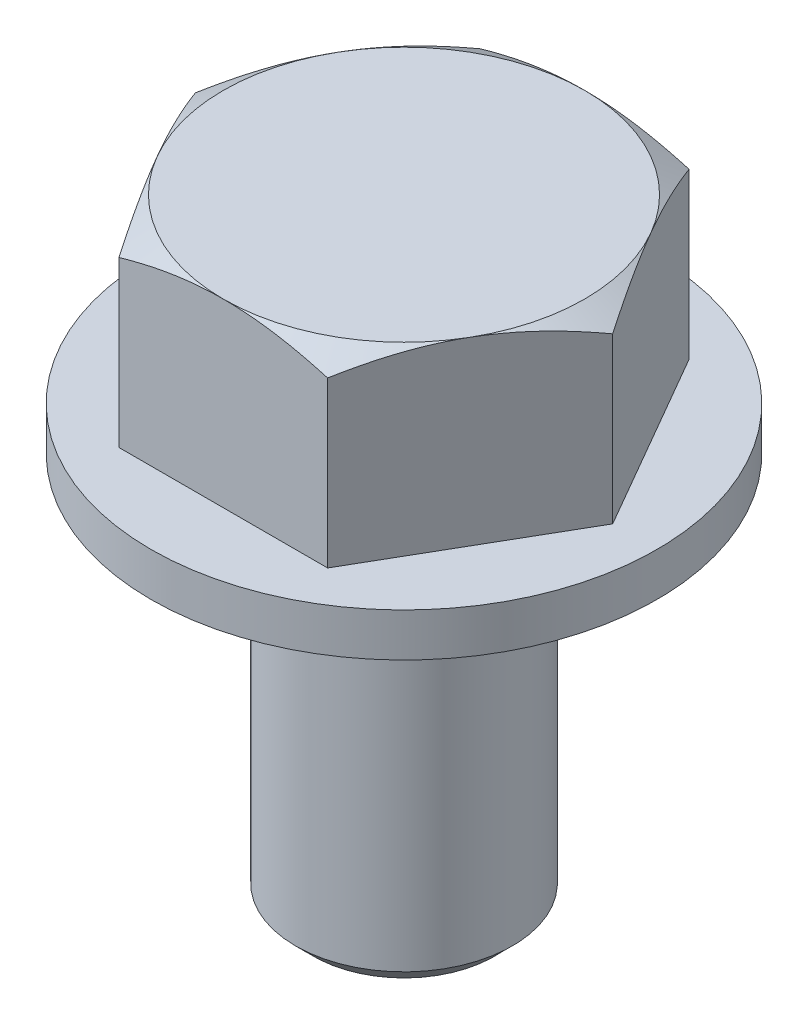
SolidWorks part; units mm, degrees
ref_plane "Plan de face" through (0, 0, 0) normal (0, 0, 1) x (1, 0, 0)
ref_plane "Plan de dessus" through (0, 0, 0) normal (0, 1, 0) x (1, 0, 0)
ref_plane "Plan de droite" through (0, 0, 0) normal (1, 0, 0) x (0, 0, -1)
sketch "Esquisse1" plane through (0, 0, 0) normal (0, 1, 0) x (1, 0, 0)
  line L1 (5.7735, 0) -> (2.8868, 5)
  line L2 (2.8868, 5) -> (-2.8868, 5)
  line L3 (-2.8868, 5) -> (-5.7735, 0)
  line L4 (-5.7735, 0) -> (-2.8868, -5)
  line L5 (-2.8868, -5) -> (2.8868, -5)
  line L6 (2.8868, -5) -> (5.7735, 0)
  circle A0 centre (0, 0) radius 5 construction
  dimension "D1" = 10
extrude "Extrusion1" add sketch "Esquisse1" along normal mid plane 5
sketch "Esquisse2" plane through (0, 0, 0) normal (1, 0, 0) x (0, 0, -1)
  line L0 (2, 4.2321) -> (8, 4.2321)
  line L1 (8, 4.2321) -> (8, 0.7679)
  line L2 (8, 0.7679) -> (2, 4.2321)
  line L3 (0, 9.378) -> (0, -1.3286) construction
  dimension "D1" = 30
  dimension "D2" = 3
revolve "Enlèvement de matière-Révolution4" cut sketch "Esquisse2" angle 360 about L3
sketch "Esquisse3" plane through (0, -2.5, 0) normal (0, -1, 0) x (1, 0, 0)
  circle A0 centre (0, 0) radius 3
  dimension "D1" = 6
extrude "Extrusion2" add sketch "Esquisse3" along normal blind 12
chamfer "Chanfrein1" distance 0.5 angle 45 1 edges at (0, -14.5, -3)
sketch "Esquisse4" plane through (0, 0, 0) normal (0, 0, 1) x (1, 0, 0)
  line L0 (0, 0) -> (0, -11.4545) construction
  line L1 (2.8868, -2.5) -> (5.7735, -2.5) construction
  line L2 (3.5, -2.5) -> (7, -2.5)
  line L3 (3.5, -2.5) -> (3.5, -3.7)
  line L4 (3.5, -3.7) -> (7, -3.7)
  line L5 (7, -2.5) -> (7, -3.7)
  dimension "D1" = 14
  dimension "D2" = 1.2
  dimension "D3" = 7
revolve "Révolution1" add sketch "Esquisse4" angle 360 about L0
